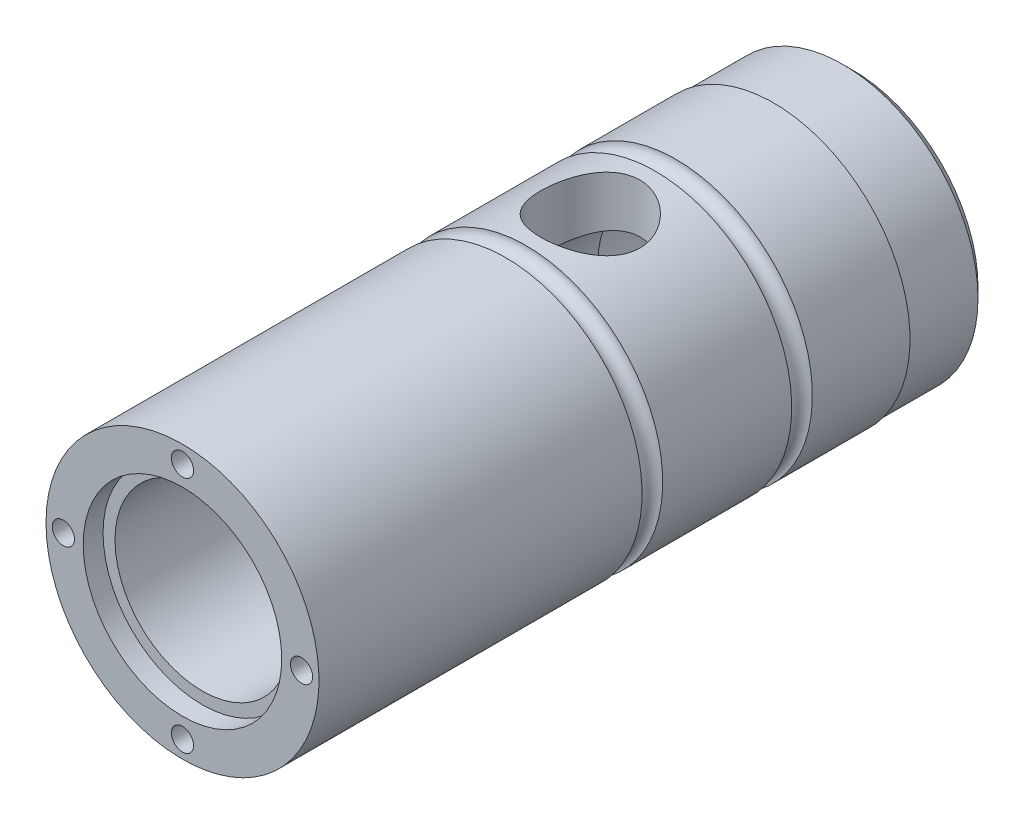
SolidWorks part; units mm, degrees
ref_plane "Plane1" through (0, 0, 0) normal (0, 0, 1) x (1, 0, 0)
ref_plane "Plane2" through (0, 0, 0) normal (0, 1, 0) x (1, 0, 0)
ref_plane "Plane3" through (0, 0, 0) normal (1, 0, 0) x (0, 0, -1)
sketch "Sketch1" plane through (0, 0, 0) normal (0, 0, 1) x (1, 0, 0)
  circle A0 centre (0, 0) radius 17.4625
  dimension "D1" = 34.925
extrude "Base-Extrude" add sketch "Sketch1" along normal blind 85.8012
sketch "Sketch2" plane through (0, 0, 85.8012) normal (0, 0, 1) x (1, 0, 0)
  circle A0 centre (0, 0) radius 8.9916
  dimension "D1" = 17.9832
extrude "c_bore" cut sketch "Sketch2" against normal through all
sketch "Sketch3" plane through (0, 0, 85.8012) normal (0, 0, 1) x (1, 0, 0)
  circle A0 centre (0, 0) radius 11.176
  dimension "D1" = 22.352
extrude "b_bore" cut sketch "Sketch3" against normal blind 23.2156
sketch "Sketch4" plane through (0, 0, 85.8012) normal (0, 0, 1) x (1, 0, 0)
  circle A0 centre (0, 0) radius 12.7
  dimension "D1" = 25.4
extrude "a_bore" cut sketch "Sketch4" against normal blind 2.54
sketch "Sketch5" plane through (0, 0, 0) normal (0, 0, -1) x (-1, 0, 0)
  circle A0 centre (0, 0) radius 12.4968
  dimension "D1" = 24.9936
extrude "f_bore" cut sketch "Sketch5" against normal blind 21.463
sketch "Sketch6" plane through (0, 0, 0) normal (0, 0, -1) x (-1, 0, 0)
  circle A0 centre (0, 0) radius 11.1506
  dimension "D1" = 22.3012
extrude "e_bore" cut sketch "Sketch6" against normal blind 35.56
sketch "Sketch7" plane through (0, 0, 0) normal (0, 0, -1) x (-1, 0, 0)
  circle A0 centre (0, 0) radius 11.0109
  dimension "D1" = 22.0218
extrude "d_bore" cut sketch "Sketch7" against normal blind 57.0738
sketch "Sketch8" plane through (0, 0, 85.8012) normal (0, 0, 1) x (1, 0, 0)
  line L0 (-3.2453, 0) -> (3.6969, 0) construction
  line L1 (0, 2.173) -> (0, -2.0601) construction
  circle A0 centre (0, 15.24) radius 1.4224
  circle A1 centre (0, -15.24) radius 1.4224
  circle A2 centre (15.24, 0) radius 1.4224
  circle A3 centre (-15.24, 0) radius 1.4224
extrude "4-40 X 0.25" cut sketch "Sketch8" against normal blind 6.35
chamfer "Chamfer1" distance 0.762 angle 15 1 edges at (8.9916, 0, 62.5856)
fillet "Fillet1" radius 0.254 1 edges at (-11.0109, 0, 57.0738)
chamfer "Chamfer2" distance 0.1397 distance2 0.5334 1 edges at (-11.0109, 0, 35.56)
chamfer "Chamfer3" distance 0.4394 angle 60 1 edges at (-12.4968, 0, 0)
ref_plane "Plane4" through (0, 19.05, 0) normal (0, 1, 0) x (-1, 0, 0)
sketch "Sketch11" plane through (0, 0, 0) normal (0, 0, -1) x (-1, 0, 0)
  circle A0 centre (0, 0) radius 17.272
extrude "Cut-Extrude4" cut sketch "Sketch11" against normal blind 10.16 flip side to cut
chamfer "Chamfer6" distance 1.27 angle 45 1 edges at (-17.272, 0, 0)
sketch "Sketch14" plane through (0, 0, 0) normal (1, 0, 0) x (0, 0, -1)
  line L0 (-25.2984, 17.4625) -> (-22.6568, 17.4625)
  line L2 (-10.16, 17.4625) -> (-85.8012, 17.4625) construction
  line L4 (-43.1292, 17.4625) -> (-41.8084, 17.4625)
  line L5 (12.8258, 0) -> (-65.8588, 0) construction
  line L6 (-43.1292, 17.4625) -> (-44.45, 17.4625)
  arc A0 (-25.2984, 17.4625) -> (-22.6568, 17.4625) centre (-23.9776, 17.4625) ccw
  arc A3 (-44.45, 17.4625) -> (-41.8084, 17.4625) centre (-43.1292, 17.4625) ccw
revolve "Cut-Revolve7" cut sketch "Sketch14" angle 360 about L5
sketch "Sketch15" plane through (0, 0, 0) normal (0, 1, 0) x (1, 0, 0)
  circle A0 centre (0, -33.6128) radius 6.35
extrude "Cut-Extrude5" cut sketch "Sketch15" along normal blind 22.86
sketch "Sketch16" plane through (0, 0, 0) normal (1, 0, 0) x (0, 0, -1)
  line L1 (-33.6128, 17.4625) -> (-33.6128, 9.3312) construction
  line L2 (-41.8084, 0) -> (-25.2984, 0) construction
  circle A0 centre (-33.6128, 0) radius 6.35
extrude "Cut-Extrude6" cut sketch "Sketch16" against normal blind 22.86
sketch "Sketch17" plane through (0, 0, 57.0738) normal (0, 0, -1) x (-1, 0, 0)
  circle A0 centre (0, 0) radius 8.4836
  circle A1 centre (0, 0) radius 9.8814
extrude "Extrude1" add sketch "Sketch17" against normal blind 0.508
